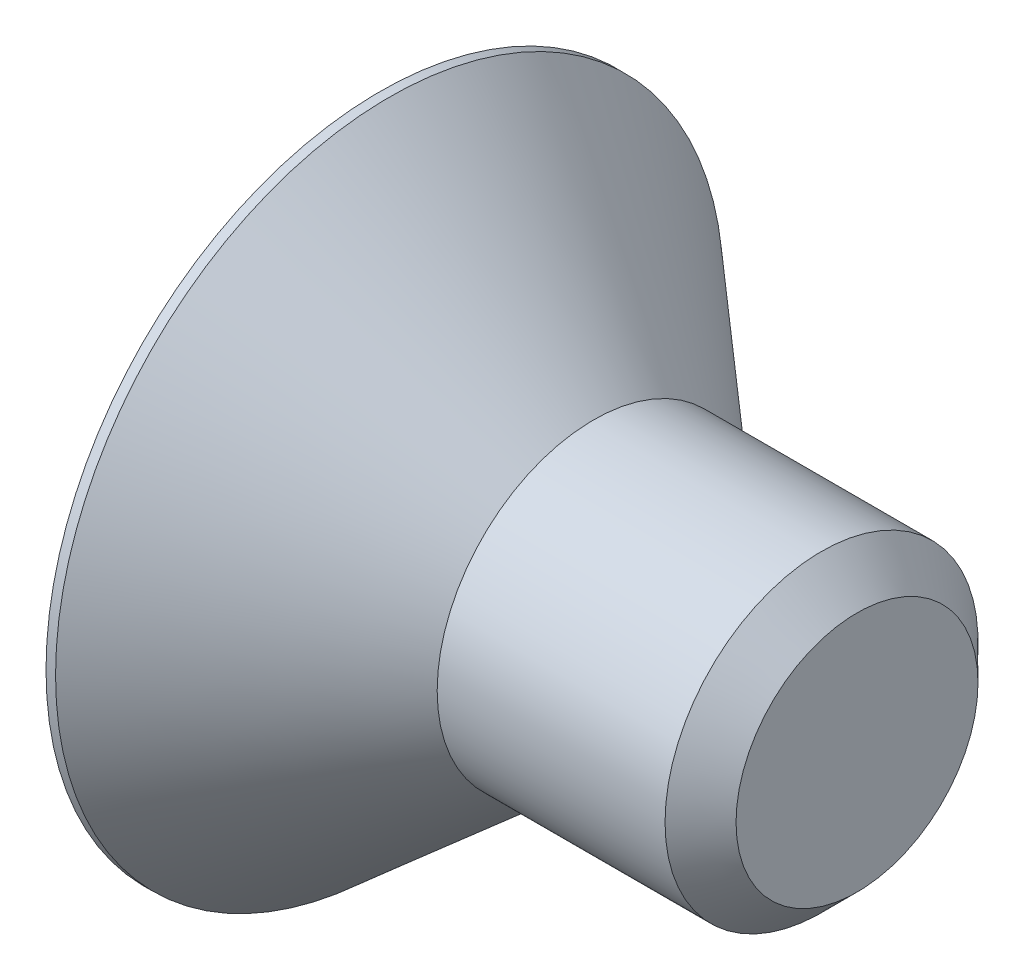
SolidWorks part; units mm, degrees
revolve "PreBroach" cut sketch "Sketch2"
sketch "Sketch2"
  line L0 (0, 1.1938) -> (1.9304, 1.1938)
  line L1 (1.9304, 1.1938) -> (2.6196, 0)
  line L2 (0, 0) -> (127, 0) construction
  line L3 (2.6196, 0) -> (0, 0)
  line L4 (0, 0) -> (0, 1.1938)
  line L5 (0, -1.1938) -> (1.9304, -1.1938) construction
  line L6 (0, 0) -> (47.625, 0) construction
  line L8 (0, 4.445) -> (0, -4.445) construction
revolve "BaseBody" add sketch "BodySke" angle 360 about L6
sketch "BodySke" plane through (0, 0, 0) normal (0, 0, 1) x (1, 0, 0)
  line L0 (0, 0) -> (0, 4.445)
  line L1 (0.127, 4.445) -> (2.8444, 2.0828)
  line L2 (0, 4.445) -> (0.127, 4.445)
  line L3 (2.8444, 2.0828) -> (5.8776, 2.0828)
  line L4 (6.35, 1.6104) -> (6.35, 0)
  line L5 (6.35, 0) -> (0, 0)
  line L6 (0, 0) -> (127, 0) construction
  line L7 (0.127, -4.445) -> (2.8444, -2.0828) construction
  line L8 (6.35, 1.6104) -> (5.8776, 2.0828)
  line L9 (0, -4.445) -> (0.127, -4.445) construction
  line L10 (6.35, -1.6104) -> (5.8776, -2.0828) construction
  line L11 (3.6369, 8.4328) -> (3.6369, -13.7922) construction
  line L12 (0, 19.05) -> (0, -3.175) construction
ref_plane "Plane1" through (0, 0, 0) normal (0, 0, 1) x (1, 0, 0)
ref_plane "Plane2" through (0, 0, 0) normal (0, 1, 0) x (1, 0, 0)
ref_plane "Plane3" through (0, 0, 0) normal (1, 0, 0) x (0, 0, -1)
sketch "Sketch3" plane through (0, 0, 0) normal (-1, 0, 0) x (0, 0, 1)
  line L0 (-1.1938, -0.6892) -> (-1.1938, 0.6892)
  line L1 (-1.1938, 0.6892) -> (0, 1.3785)
  line L2 (0, 1.3785) -> (1.1938, 0.6892)
  line L3 (1.1938, 0.6892) -> (1.1938, -0.6892)
  line L4 (1.1938, -0.6892) -> (0, -1.3785)
  line L5 (0, -1.3785) -> (-1.1938, -0.6892)
extrude "Hex" cut sketch "Sketch3" against normal blind 1.9304
sketch "Sketch4" plane through (0, 0, 0) normal (-1, 0, 0) x (0, 0, 1)
  line L0 (0, 0) -> (1.4605, 0)
  line L1 (0, 0) -> (6.1484, 3.5498) construction
  line L2 (0, 0) -> (0.7302, 1.2648)
  line L3 (1.2009, 0.3267) -> (1.3933, 0.4378)
  line L4 (0.8834, 0.8767) -> (1.0758, 0.9877)
  arc A0 (1.2009, 0.3267) -> (0.8834, 0.8767) centre (0, 0) ccw
  arc A1 (1.4605, 0) -> (1.3933, 0.4378) centre (0, 0) ccw
  arc A2 (0.7302, 1.2648) -> (1.0758, 0.9877) centre (0, 0) cw
extrude "Spline" [suppressed] cut sketch "Sketch4" against normal blind 1.9304
pattern_circular "CirPattern1" [suppressed] count 6 every 60 about axis through (0, 0, 0) along (1, 0, 0)
sketch "ThdSchSke" plane through (0, 0, 0) normal (0, 0, 1) x (1, 0, 0)
  line L0 (3.5099, -1.6104) -> (3.1791, -2.0828)
  line L1 (3.5099, -1.6104) -> (3.8407, -2.0828)
  line L2 (3.8407, -2.0828) -> (3.8407, -2.6035)
  line L3 (-3.175, 0) -> (5.1513, 0) construction
  line L4 (0, 4.445) -> (0, -4.445) construction
  line L5 (3.8407, -2.6035) -> (3.1791, -2.6035)
  line L6 (3.1791, -2.6035) -> (3.1791, -2.0828)
revolve "ThreadSchematic" [suppressed] cut sketch "ThdSchSke" angle 360 about L3
pattern_linear "ThdSchPat" [suppressed]
equation "\"D3@Sketch4\" = \"Spline_p_dim@Sketch4\" / 2"
equation "\"Thread_minor@ThreadCosmetic\"  =  \"Minor_dia@BodySke\""
equation "\"D2@CirPattern1\" = 360 / \"Num_teeth@CirPattern1\""
equation "\"D1@Sketch3\" = \"Hex_size@Sketch3\" / 2"
equation "\"D2@Sketch3\" = \"D1@Sketch3\""
equation "\"D3@Sketch3\" = \"Hex_size@Sketch3\""
equation "\"Thread_length@ThreadCosmetic\" = ((sgn( (\"Length@BodySke\" - \"Advance@BodySke\" - ( ( ( \"Head_dia@BodySke\" - \"Diameter@BodySke\" ) * 0.5 ) / tan( \"Head_ang@BodySke\" * 0.008726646 ) ) ) - \"Thread_nom@Body"
equation "\"Thread_minor@ThdSchSke\" = \"Minor_dia@BodySke\""
equation "\"Diameter@ThdSchSke\" = \"Diameter@BodySke\""
equation "\"Overcut@ThdSchSke\" = \"Diameter@BodySke\" * 1.25"
equation "\"Start@ThdSchSke\" = 0.000001 + \"Length@BodySke\" - \"Thread_length@ThreadCosmetic\"  '---Countersunk---"
equation "\"Num_threads@ThdSchPat\" = int( \"Thread_length@ThreadCosmetic\" / \"Advance@BodySke\" + 0.999 )  + 1"
equation "\"Advance@ThdSchPat\" = \"Thread_length@ThreadCosmetic\" /  (\"Num_threads@ThdSchPat\" - 1) 'relax it"
equation "\"Num_threads@ThdSchPat\" = \"Num_threads@ThdSchPat\" - sgn( \"Num_threads@ThdSchPat\" - 1) '---chamfered tips only---"
